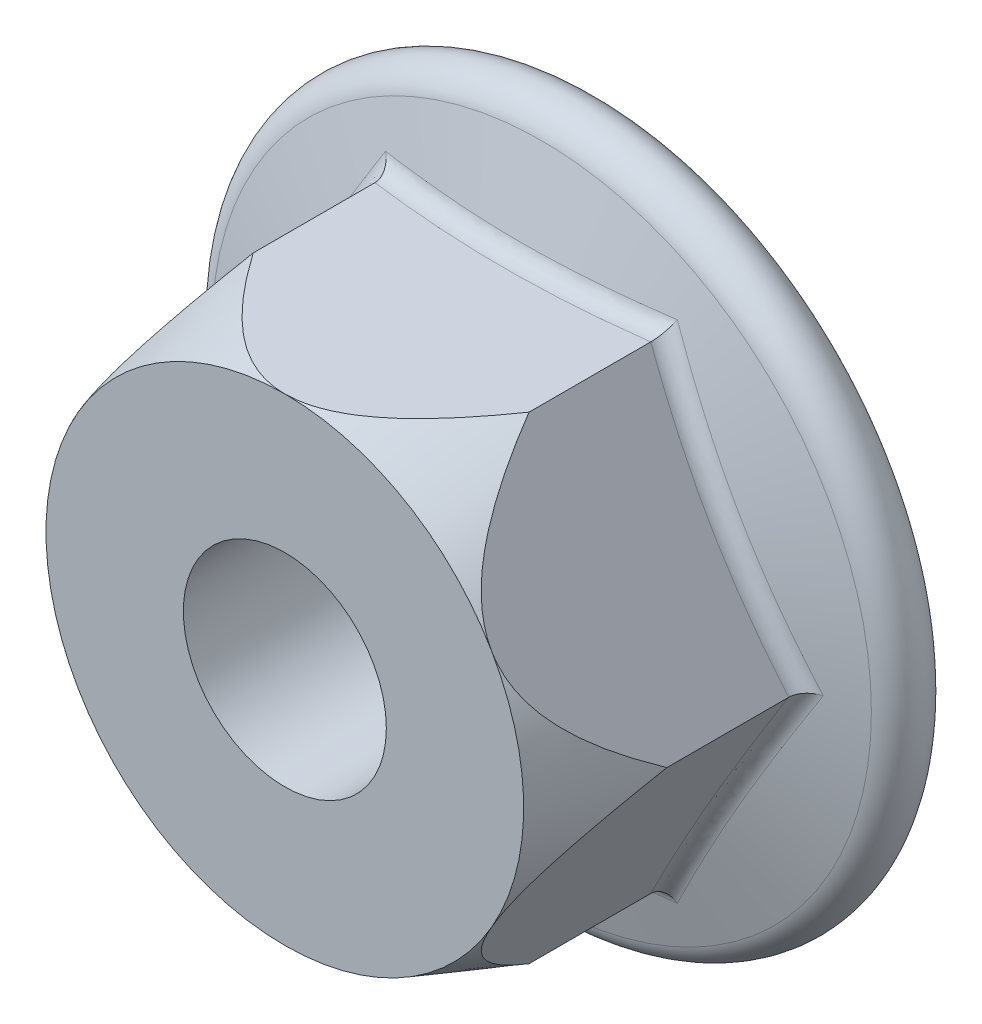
SolidWorks part; units mm, degrees
ref_plane "Front" through (0, 0, 0) normal (0, 0, 1) x (1, 0, 0)
ref_plane "Top" through (0, 0, 0) normal (0, 1, 0) x (1, 0, 0)
ref_plane "Right" through (0, 0, 0) normal (1, 0, 0) x (0, 0, -1)
other "Configuration Table"
sketch "Sketch1" plane through (0, 0, 0) normal (0, 0, 1) x (1, 0, 0)
  line L1 (4.6188, 0) -> (2.3094, 4)
  line L2 (2.3094, 4) -> (-2.3094, 4)
  line L3 (-2.3094, 4) -> (-4.6188, 0)
  line L4 (-4.6188, 0) -> (-2.3094, -4)
  line L5 (-2.3094, -4) -> (2.3094, -4)
  line L6 (2.3094, -4) -> (4.6188, 0)
  circle A0 centre (0, 0) radius 4 construction
extrude "BaseNut" add sketch "Sketch1" against normal blind 5.3
sketch "Sketch2" plane through (-0.4812, 0, -5.1) normal (0, 1, 0) x (0, 0, -1)
  line L0 (-0.1158, 4.1376) -> (0.2, 4.1376)
  line L2 (0.2, 4.1376) -> (0.2, 2.9588)
  line L4 (0.2, 2.9588) -> (-0.1158, 4.1376)
  line L5 (-3.32, 4.1376) -> (-5.1, 4.1376)
  line L6 (-5.1, 4.1376) -> (-5.1, 3.5188)
  line L8 (-5.1, 3.5188) -> (-3.32, 4.1376)
  line L9 (0, -0.4812) -> (-5.5811, -0.4812) construction
  line L10 (-5.1, 1.8282) -> (-5.1, 4.1376) construction
  line L11 (0.2, 4.1376) -> (-5.1, 4.1376) construction
  line L12 (0.2, 4.1376) -> (0.2, 1.8282) construction
revolve "Double-Chamfer" cut sketch "Sketch2" angle 360 about L9
sketch "Sketch3" plane through (0, 0, 0) normal (0, 0, 1) x (1, 0, 0)
  circle A0 centre (0, 0) radius 1.7
extrude "Hole" cut sketch "Sketch3" against normal through all
chamfer "EndChamfer" distance 0.4857 angle 45 1 edges at (1.7, 0, -5.3)
sketch "Sketch4" plane through (0.0678, 0, -5.8322) normal (0, 1, 0) x (0, 0, -1)
  line L0 (-0.5322, 3.5078) -> (-0.5322, 5.4592)
  line L1 (-0.7835, 5.5908) -> (-1.5322, 5.5908) construction
  line L2 (-1.5322, 5.5908) -> (-1.7744, 4.6866)
  line L3 (-0.5322, 4.6866) -> (-0.5322, 3.5078) construction
  line L4 (-1.7744, 4.6866) -> (-1.7744, 3.5078) construction
  line L5 (-1.7744, 3.5078) -> (-0.5322, 3.5078)
  line L6 (-0.7835, 0.0678) -> (-6.5479, 0.0678) construction
  line L8 (-1.7744, 3.5078) -> (-2.0903, 3.5078)
  line L9 (-1.7744, 4.6866) -> (-2.0903, 3.5078)
  line L12 (-0.848, 4.6866) -> (-4.0522, 4.6866) construction
  arc A0 (-0.5322, 5.4592) -> (-1.5322, 5.5908) centre (-1.0408, 5.4592) ccw
  dimension "D1" = 11.8
  dimension "h1" = 1
  dimension "D2" = 15
revolve "Flange" add sketch "Sketch4" angle 360 about L6
fillet "FlangeFillet" radius 0.3 6 edges
sketch "Sketch5" plane through (0, 0, 0) normal (0, 1, 0) x (1, 0, 0)
  line L0 (0, 6.0366) -> (0, -0.8862) construction
  line L1 (1.4, 4.9643) -> (1.7, 4.9643)
  line L2 (1.7, 4.9643) -> (1.9598, 4.8143)
  line L3 (1.9598, 4.8143) -> (1.7, 4.6643)
  line L4 (1.7, 4.6643) -> (1.4, 4.6643)
  line L5 (1.4, 4.6643) -> (1.4, 4.9643)
  line L6 (1.7, 4.8143) -> (-1.7, 4.8143) construction
revolve "Cut-Revolve10" [suppressed] cut sketch "Sketch5" angle 360 about L0
pattern_linear "LPattern10" [suppressed] count 13 spacing 0.36
equation "\"e@Sketch2\" = \"s@Sketch1\""
equation "\"D1@EndChamfer\" = \"D1@Sketch3\" / 7"
equation "\"D2@Sketch5\" = \"D1@Sketch3\""
equation "\"D1@Sketch5\" = (  \"D2@ThreadCosmetic1\" - \"D1@Sketch3\" )  / 2"
equation "\"D3@LPattern10\" = \"D1@Sketch5\" * 1.2"
equation "\"D1@LPattern10\" = (  \"h@BaseNut\"  - \"D1@EndChamfer\" ) / \"D3@LPattern10\" "
